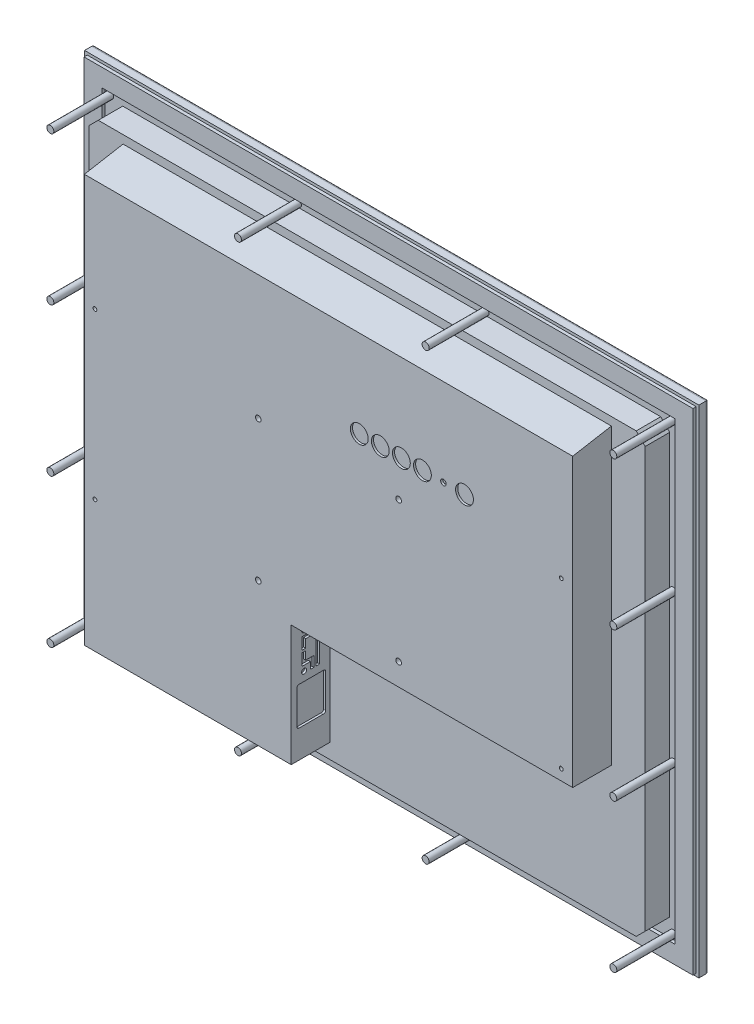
SolidWorks part; units mm, degrees
ref_plane "Front Plane" through (0, 0, 0) normal (0, 0, 1) x (1, 0, 0)
ref_plane "Top Plane" through (0, 0, 0) normal (0, 1, 0) x (1, 0, 0)
ref_plane "Right Plane" through (0, 0, 0) normal (1, 0, 0) x (0, 0, -1)
sketch "Sketch1" plane through (0, 0, 0) normal (0, 0, 1) x (1, 0, 0)
  line L0 (-218.8845, 176.784) -> (218.8845, 176.784)
  line L1 (218.8845, 176.784) -> (218.8845, -176.784)
  line L2 (218.8845, -176.784) -> (-218.8845, -176.784)
  line L3 (-218.8845, -176.784) -> (-218.8845, 176.784)
  point P2 (0, -176.784)
  point P3 (218.8845, 0)
  dimension "D1" = 437.769
  dimension "D2" = 353.568
extrude "Bezel" add sketch "Sketch1" against normal blind 7.112
fillet "Bezel Radius" radius 2 4 edges at (0, -176.784, -7.112) (0, 176.784, -7.112) (-218.8845, 0, -7.112) (218.8845, 0, -7.112)
sketch "Sketch2" plane through (0, 0, -7.112) normal (0, 0, -1) x (-1, 0, 0)
  line L0 (-170.18, 136.398) -> (170.18, 136.398)
  line L1 (170.18, 136.398) -> (170.18, -136.398)
  line L2 (170.18, -136.398) -> (-170.18, -136.398)
  line L3 (-170.18, -136.398) -> (-170.18, 136.398)
  line L4 (216.8845, 174.784) -> (-216.8845, 174.784) construction
  line L5 (-216.8845, 174.784) -> (-216.8845, -174.784) construction
  point P0 (0, 136.398)
  point P6 (0, 174.784)
  point P8 (-170.18, 0)
  point P11 (-216.8845, 0)
  dimension "D1" = 340.36
  dimension "D2" = 272.796
extrude "Window" cut sketch "Sketch2" against normal blind 2.35
sketch "Sketch3" plane through (0, 0, 0) normal (0, 0, 1) x (1, 0, 0)
  line L4 (-216.9795, 174.879) -> (216.9795, 174.879)
  line L5 (216.9795, 174.879) -> (216.9795, -174.879)
  line L6 (216.9795, -174.879) -> (-216.9795, -174.879)
  line L7 (-216.9795, -174.879) -> (-216.9795, 174.879)
  line L8 (218.8845, 176.784) -> (-218.8845, 176.784) construction
  line L9 (-218.8845, 176.784) -> (-218.8845, -176.784) construction
  line L10 (-218.8845, -176.784) -> (218.8845, -176.784) construction
  line L11 (218.8845, -176.784) -> (218.8845, 176.784) construction
  line L12 (-204.2795, -162.179) -> (-204.2795, 162.179)
  line L13 (-204.2795, 162.179) -> (204.2795, 162.179)
  line L14 (204.2795, 162.179) -> (204.2795, -162.179)
  line L15 (204.2795, -162.179) -> (-204.2795, -162.179)
  dimension "D1" = 1.905
  dimension "D2" = 1.905
  dimension "D3" = 1.905
  dimension "D4" = 1.905
  dimension "D5" = 12.7
extrude "Gasket" add sketch "Sketch3" along normal blind 2.3
sketch "Sketch5" plane through (0, 0, 0) normal (0, 0, 1) x (1, 0, 0)
  line L0 (-218.8845, 176.784) -> (-218.8845, -176.784) construction
  line L1 (218.8845, 176.784) -> (-218.8845, 176.784) construction
  line L2 (-218.8845, -176.784) -> (218.8845, -176.784) construction
  line L4 (218.8845, -176.784) -> (218.8845, 176.784) construction
  circle A0 centre (-200.5965, 158.496) radius 2.5
  circle A6 centre (-200.5965, -158.496) radius 2.5
  circle A8 centre (-66.8655, 158.496) radius 2.5
  circle A9 centre (-66.8655, -158.496) radius 2.5
  circle A10 centre (66.8655, 158.496) radius 2.5
  circle A11 centre (66.8655, -158.496) radius 2.5
  circle A12 centre (200.5965, 158.496) radius 2.5
  circle A13 centre (200.5965, -158.496) radius 2.5
  circle A14 centre (-200.5965, 52.832) radius 2.5
  circle A15 centre (200.5965, 52.832) radius 2.5
  circle A16 centre (-200.5965, -52.832) radius 2.5
  circle A17 centre (200.5965, -52.832) radius 2.5
  dimension "D1" = 5
  dimension "D2" = 18.288
  dimension "D3" = 18.288
  dimension "D4" = 18.288
  dimension "D5" = 18.288
  dimension "D6" = 4
  dimension "D7" = 3
  dimension "D8" = 105.664
extrude "Panel Frame Studs" add sketch "Sketch5" along normal blind 42.7
sketch "Sketch6" plane through (0, 0, 0) normal (0, 0, 1) x (1, 0, 0)
  line L0 (-198.0965, 149.5841) -> (-191.6846, 155.996)
  line L1 (-191.6846, 155.996) -> (191.6846, 155.996)
  line L2 (191.6846, 155.996) -> (198.0965, 149.5841)
  line L3 (198.0965, 149.5841) -> (198.0965, -149.5841)
  line L4 (198.0965, -149.5841) -> (191.6846, -155.996)
  line L5 (191.6846, -155.996) -> (-191.6846, -155.996)
  line L6 (-191.6846, -155.996) -> (-198.0965, -149.5841)
  line L7 (-198.0965, -149.5841) -> (-198.0965, 149.5841)
  circle A0 centre (-200.5965, 158.496) radius 2.5 construction
  circle A1 centre (200.5965, 158.496) radius 2.5 construction
  circle A2 centre (-200.5965, -158.496) radius 2.5 construction
  dimension "D1" = 9.0678
  dimension "D2" = 45
extrude "Body" add sketch "Sketch6" along normal blind 17.4498 separate body
sketch "Sketch7" plane through (0, 0, 17.4498) normal (0, 0, 1) x (1, 0, 0)
  line L0 (-173.99, 150.1394) -> (173.99, 150.1394)
  line L1 (173.99, 150.1394) -> (173.99, -59.2074)
  line L2 (173.99, -59.2074) -> (-26.6192, -59.2074)
  line L3 (-26.6192, -59.2074) -> (-26.6192, -145.3896)
  line L4 (-26.6192, -145.3896) -> (-173.99, -145.3896)
  line L5 (-173.99, -145.3896) -> (-173.99, 150.1394)
  line L6 (-191.6846, -155.996) -> (191.6846, -155.996) construction
  line L7 (-218.8845, -176.784) -> (218.8845, -176.784) construction
  line L9 (-198.0965, 149.5841) -> (-198.0965, -149.5841) construction
  point P3 (0, 150.1394)
  dimension "D1" = 347.98
  dimension "D2" = 209.3468
  dimension "D3" = 200.6092
  dimension "D4" = 86.1822
  dimension "D5" = 31.3944
extrude "Rear Cover" add sketch "Sketch7" along normal blind 27.559
draft "Rear Cover Slope" type of draft neutral plane draft angle 10 faces to draft 1 parameters "D1"=10
hole_wizard "Ø4.0mm VESA Holes" positions "Sketch8" profile "Sketch9" hole size "Ø4.0" standard "ANSI Metric"
sketch "Sketch8" plane through (0, 0, 45.0088) normal (0, 0, 1) x (1, 0, 0)
  line L0 (-218.8845, -176.784) -> (218.8845, -176.784) construction
  line L1 (-218.8845, 176.784) -> (-218.8845, -176.784) construction
  point P0 (-50.0253, 56.5152)
  point P2 (49.9747, 56.5152)
  point P4 (49.9747, -43.4848)
  point P6 (-50.0253, -43.4848)
  dimension "D1" = 100
  dimension "D2" = 100
  dimension "D3" = 133.2992
  dimension "D4" = 168.8592
sketch "Sketch9" plane through (-50.0253, 56.5152, 45.0088) normal (1, 0, 0) x (0, -1, 0)
  line L0 (0, 0) -> (0, 17.2037)
  line L1 (0, 17.2037) -> (2, 16.002)
  line L2 (2, 16.002) -> (2, 0)
  line L5 (2, 0) -> (0, 0)
  line L10 (0, 17.2037) -> (-2, 16.002) construction
  line L11 (0, -6.35) -> (0, 107.95) construction
  dimension "Hole Dia." = 4
  dimension "Hole Depth" = 16.002
  dimension "Drill Angle" = 118
sketch "Sketch10" plane through (0, -59.2074, 0) normal (0, 1, 0) x (1, 0, 0)
  line L0 (173.99, -45.0088) -> (173.99, -17.4498) construction
  line L1 (-26.6192, -45.0088) -> (173.99, -45.0088) construction
  line L53 (51.4743, -30.7409) -> (51.4743, -25.6609)
  line L54 (27.1983, -33.9134) -> (48.4263, -33.9134)
  line L55 (27.1983, -22.4885) -> (48.4263, -22.4885)
  line L56 (24.1503, -25.6609) -> (24.1503, -30.7409)
  line L57 (85.6427, -27.1722) -> (85.6427, -32.2522)
  line L58 (68.3707, -35.4247) -> (82.5947, -35.4247)
  line L59 (65.3227, -27.1722) -> (65.3227, -32.2522)
  line L60 (68.3707, -23.9998) -> (82.4671, -23.9972)
  line L61 (109.9921, -26.8166) -> (109.9921, -31.8966)
  line L62 (127.2641, -23.6442) -> (113.0401, -23.6442)
  line L63 (130.3121, -31.8966) -> (130.3121, -26.8166)
  line L64 (113.0401, -35.0691) -> (127.1365, -35.0716)
  line L65 (161.9307, -23.2479) -> (145.9287, -23.2479)
  line L66 (161.9307, -30.9314) -> (161.9307, -35.4399)
  line L67 (145.9287, -35.4399) -> (161.9307, -35.4399)
  line L68 (145.9287, -30.9314) -> (145.9287, -35.4399)
  line L69 (141.4837, -30.9314) -> (145.9287, -30.9314)
  line L70 (141.4837, -27.7564) -> (145.9287, -27.7564)
  line L71 (145.9287, -23.2479) -> (145.9287, -27.7564)
  line L72 (161.9307, -27.7564) -> (161.9307, -23.2479)
  line L73 (161.9307, -30.9314) -> (166.3757, -30.9314)
  line L74 (161.9307, -27.7564) -> (166.3757, -27.7564)
  circle A42 centre (54.0683, -28.2009) radius 1.5875
  arc A43 (51.4743, -30.7409) -> (48.4263, -33.9134) centre (48.2993, -30.7409) cw
  arc A44 (48.4263, -22.4885) -> (51.4743, -25.6609) centre (48.2993, -25.6609) cw
  arc A45 (24.1503, -25.6609) -> (27.1983, -22.4885) centre (27.3253, -25.6609) cw
  arc A46 (27.1983, -33.9134) -> (24.1503, -30.7409) centre (27.3253, -30.7409) cw
  circle A47 centre (21.5563, -28.2009) radius 1.5875
  arc A48 (68.3707, -35.4247) -> (65.3227, -32.2522) centre (68.4977, -32.2522) cw
  circle A49 centre (87.9827, -29.7249) radius 1.5875
  arc A50 (85.6427, -32.2522) -> (82.5947, -35.4247) centre (82.4677, -32.2522) cw
  circle A51 centre (62.9827, -29.7249) radius 1.5875
  arc A52 (65.3227, -27.1722) -> (68.3707, -23.9998) centre (68.4977, -27.1722) cw
  arc A53 (82.4671, -23.9972) -> (85.6427, -27.1722) centre (82.4677, -27.1722) cw
  circle A54 centre (107.6521, -29.3439) radius 1.5875
  arc A55 (109.9921, -26.8166) -> (113.0401, -23.6442) centre (113.1671, -26.8166) cw
  arc A56 (127.2641, -23.6442) -> (130.3121, -26.8166) centre (127.1371, -26.8166) cw
  arc A57 (130.3121, -31.8966) -> (127.1365, -35.0716) centre (127.1371, -31.8966) cw
  arc A58 (113.0401, -35.0691) -> (109.9921, -31.8966) centre (113.1671, -31.8966) cw
  circle A59 centre (132.6521, -29.3439) radius 1.5875
  arc A60 (141.4837, -30.9314) -> (141.4837, -27.7564) centre (141.4837, -29.3439) cw
  arc A61 (166.3757, -27.7564) -> (166.3757, -30.9314) centre (166.3757, -29.3439) cw
  dimension "D1" = 7.6143
  dimension "D2" = 15.6649
extrude "Video / Touch Interface" cut sketch "Sketch10" along normal blind 1.524 from surface at 0
sketch "Sketch11" plane through (-26.6192, 0, 0) normal (-1, 0, 0) x (0, 0, 1)
  line L0 (45.0088, -145.3896) -> (17.4498, -145.3896) construction
  line L1 (45.0088, -145.3896) -> (45.0088, -59.2074) construction
  line L49 (31.3182, -93.3873) -> (31.3182, -88.574)
  line L50 (31.3182, -93.3873) -> (28.7782, -93.3873)
  line L51 (28.7782, -93.3873) -> (28.7782, -86.034)
  line L52 (27.2542, -65.4473) -> (27.2542, -93.3873)
  line L53 (27.2542, -93.3873) -> (24.7142, -93.3873)
  line L54 (24.7142, -93.3873) -> (24.7142, -65.4473)
  line L55 (24.7142, -65.4473) -> (27.2542, -65.4473)
  line L56 (28.7782, -65.4473) -> (31.3182, -65.4473)
  line L57 (31.3182, -65.4473) -> (31.3182, -70.2606)
  line L58 (28.7782, -65.4473) -> (28.7782, -72.8006)
  line L59 (28.7782, -72.8006) -> (34.671, -72.8006)
  line L60 (31.3182, -70.2606) -> (37.211, -70.2606)
  line L61 (37.211, -70.2606) -> (37.211, -78.6553)
  line L62 (37.211, -78.6553) -> (34.671, -78.6553)
  line L63 (34.671, -72.8006) -> (34.671, -78.6553)
  line L64 (34.671, -80.1793) -> (37.211, -80.1793)
  line L65 (37.211, -88.574) -> (37.211, -80.1793)
  line L66 (34.671, -80.1793) -> (34.671, -86.034)
  line L67 (28.7782, -86.034) -> (34.671, -86.034)
  line L68 (31.3182, -88.574) -> (37.211, -88.574)
  line L69 (20.4599, -100.1195) -> (20.4599, -124.059)
  line L70 (21.9839, -98.5955) -> (39.4353, -98.5955)
  line L71 (40.9578, -124.059) -> (40.9578, -100.1195)
  line L72 (39.4338, -125.583) -> (21.9824, -125.583)
  circle A12 centre (35.814, -92.2062) radius 1.7907
  circle A13 centre (35.814, -66.6284) radius 1.7907
  arc A14 (21.9824, -125.583) -> (20.4599, -124.059) centre (21.9839, -124.059) cw
  arc A15 (20.4599, -100.1195) -> (21.9839, -98.5955) centre (21.9839, -100.1195) cw
  arc A16 (39.4353, -98.5955) -> (40.9578, -100.1195) centre (39.4338, -100.1195) cw
  arc A17 (40.9578, -124.059) -> (39.4338, -125.583) centre (39.4338, -124.059) cw
  dimension "D1" = 19.8066
  dimension "D2" = 4.051
extrude "Power AC and DC" cut sketch "Sketch11" along normal blind 1.524 from surface at 0
sketch "Sketch12" plane through (0, 0, 45.0088) normal (0, 0, 1) x (1, 0, 0)
  line L0 (-218.8845, -176.784) -> (218.8845, -176.784) construction
  line L1 (-218.8845, 176.784) -> (-218.8845, -176.784) construction
  circle A6 centre (21.8883, 83.0427) radius 6.35
  circle A7 centre (36.8883, 83.0427) radius 6.35
  circle A8 centre (51.8883, 83.0427) radius 6.35
  circle A9 centre (66.8883, 83.0427) radius 6.35
  circle A10 centre (81.8883, 83.0427) radius 1.9812
  circle A11 centre (96.8883, 83.0427) radius 6.35
  dimension "D1" = 259.8267
  dimension "D2" = 240.7728
extrude "Controls Buttons" cut sketch "Sketch12" against normal blind 1.524 from surface at 0
hole_wizard "6-32 Accessory Bracket Holes" positions "Sketch13" profile "Sketch14" hole size "#6-32" standard "ANSI Inch"
sketch "Sketch13" plane through (0, 0, 45.0088) normal (0, 0, 1) x (1, 0, 0)
  line L0 (-218.8845, 176.784) -> (-218.8845, -176.784) construction
  line L1 (-218.8845, -176.784) -> (218.8845, -176.784) construction
  point P0 (-166.4589, -51.5874)
  point P2 (-166.4589, 65.9384)
  point P4 (165.8747, 65.9384)
  point P6 (165.8747, -51.5874)
  dimension "D1" = 117.5258
  dimension "D2" = 332.3336
  dimension "D3" = 52.4256
  dimension "D4" = 125.1966
sketch "Sketch14" plane through (-166.4589, -51.5874, 45.0088) normal (1, 0, 0) x (0, -1, 0)
  line L0 (0, 0) -> (0, 16.8147)
  line L1 (0, 16.8147) -> (1.3525, 16.002)
  line L2 (1.3525, 16.002) -> (1.3525, 0)
  line L5 (1.3525, 0) -> (0, 0)
  line L10 (0, 16.8147) -> (-1.3526, 16.002) construction
  line L11 (0, -6.35) -> (0, 107.95) construction
  dimension "Hole Dia." = 2.7051
  dimension "Hole Depth" = 16.002
  dimension "Drill Angle" = 118
